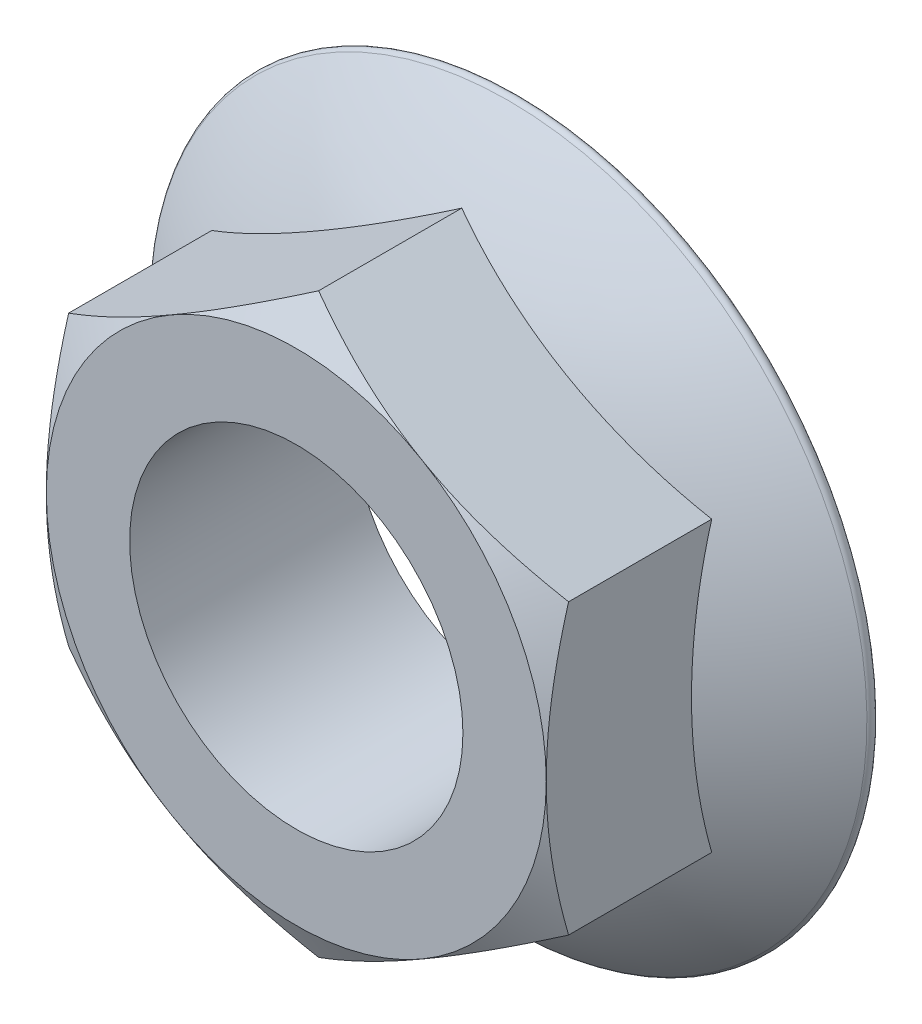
SolidWorks part; units mm, degrees
ref_plane "Front Plane" through (0, 0, 0) normal (0, 0, 1) x (1, 0, 0)
ref_plane "Top Plane" through (0, 0, 0) normal (0, 1, 0) x (1, 0, 0)
ref_plane "Right Plane" through (0, 0, 0) normal (1, 0, 0) x (0, 0, -1)
sketch "Sketch1" plane through (0, 0, 0) normal (0, 0, 1) x (1, 0, 0)
  line L1 (22.5, -12.9904) -> (22.5, 12.9904)
  line L2 (22.5, 12.9904) -> (0, 25.9808)
  line L3 (0, 25.9808) -> (-22.5, 12.9904)
  line L4 (-22.5, 12.9904) -> (-22.5, -12.9904)
  line L5 (-22.5, -12.9904) -> (0, -25.9808)
  line L6 (0, -25.9808) -> (22.5, -12.9904)
  circle A0 centre (0, 0) radius 22.5 construction
  dimension "D1" = 45
extrude "Boss-Extrude1" add sketch "Sketch1" along normal blind 20
sketch "Sketch2" plane through (0, 0, 0) normal (1, 0, 0) x (0, 0, -1)
  line L0 (0, 0) -> (-12, 0)
  line L1 (0, -31.95) -> (0, 0)
  arc A0 (-12, 0) -> (-0.894, -32.2578) centre (40.4001, 0) ccw
  arc A1 (-0.894, -32.2578) -> (0, -31.95) centre (-0.5, -31.95) ccw
  dimension "D2" = 0.5
  dimension "D1" = 12
  dimension "D3" = 31.95
revolve "Revolve1" add sketch "Sketch2" angle 360 about L0
sketch "Sketch3" plane through (0, 0, 20) normal (0, 0, 1) x (1, 0, 0)
  circle A0 centre (0, 0) radius 22.5
extrude "Cut-Extrude1" cut sketch "Sketch3" against normal blind 20 draft 60 flip side to cut
sketch "Sketch4" plane through (0, 0, 20) normal (0, 0, 1) x (1, 0, 0)
  circle A0 centre (0, 0) radius 15
  dimension "D1" = 30
extrude "Cut-Extrude2" cut sketch "Sketch4" against normal through all
